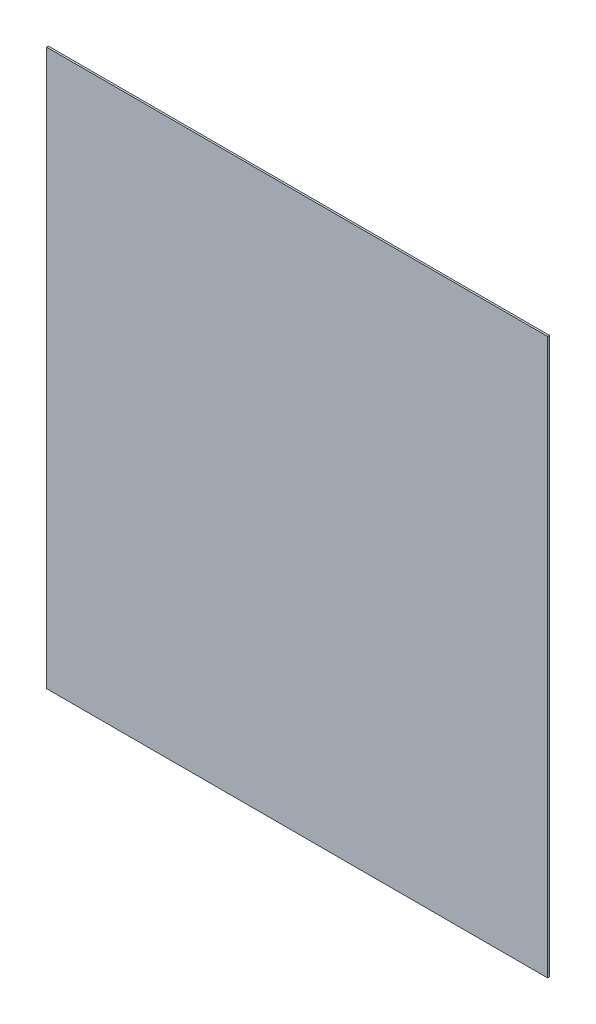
SolidWorks part; units mm, degrees
ref_plane "Ebene vorne" through (0, 0, 0) normal (0, 0, 1) x (1, 0, 0)
ref_plane "Ebene oben" through (0, 0, 0) normal (0, 1, 0) x (1, 0, 0)
ref_plane "Ebene rechts" through (0, 0, 0) normal (1, 0, 0) x (0, 0, -1)
sketch "Skizze1" plane through (0, 0, 0) normal (0, 0, 1) x (1, 0, 0)
  line L1 (-1090, 1208) -> (0, 1208)
  line L2 (-1090, 1208) -> (-1090, 0)
  line L3 (-1090, 0) -> (0, 0)
  line L4 (0, 1208) -> (0, 0)
  dimension "D1" = 1090
  dimension "D2" = 1208
extrude "Aufsatz-Linear austragen1" add sketch "Skizze1" along normal blind 4
